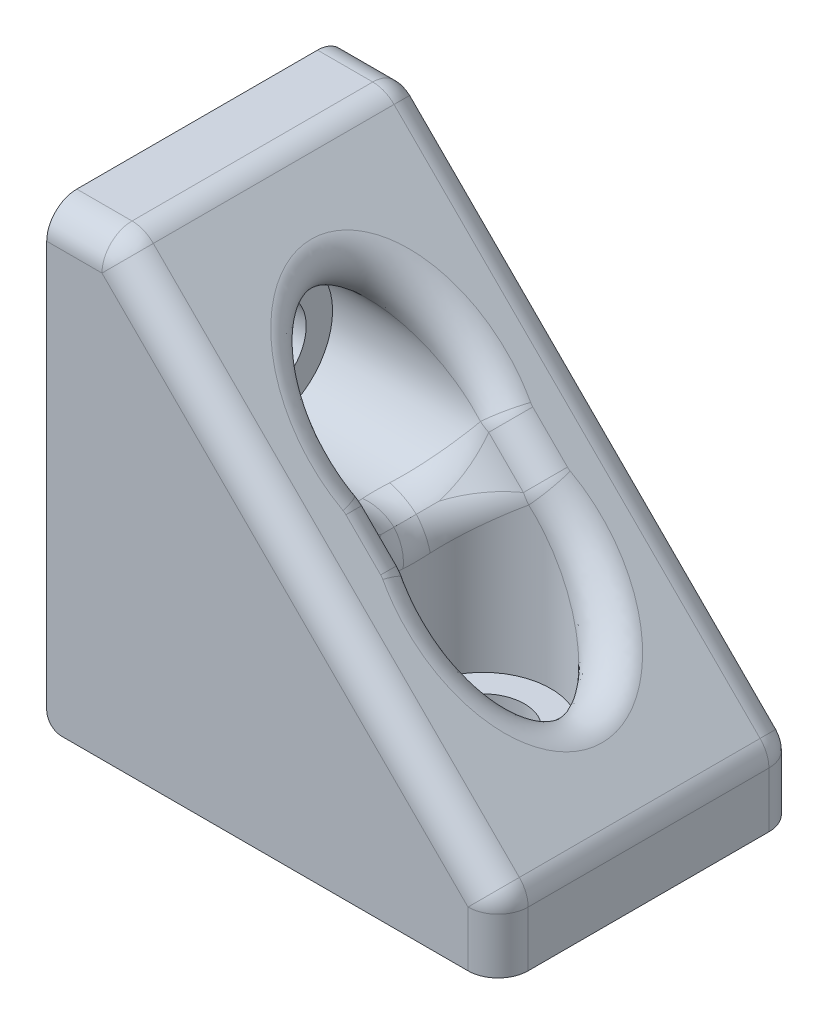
SolidWorks part; units mm, degrees
ref_plane "正面" through (0, 0, 0) normal (0, 0, 1) x (1, 0, 0)
ref_plane "平面" through (0, 0, 0) normal (0, 1, 0) x (1, 0, 0)
ref_plane "右側面" through (0, 0, 0) normal (1, 0, 0) x (0, 0, -1)
sketch "ｽｹｯﾁ1" plane through (0, 0, 0) normal (0, 0, 1) x (1, 0, 0)
  line L1 (0, 0) -> (30, 0)
  line L2 (0, 0) -> (0, 4.5)
  line L3 (0, 4.5) -> (30, 4.5)
  line L4 (30, 0) -> (30, 4.5)
  line L5 (0, 4.5) -> (4.5, 4.5)
  line L6 (0, 4.5) -> (0, 30)
  line L7 (0, 30) -> (4.5, 30)
  line L8 (4.5, 4.5) -> (4.5, 30)
  dimension "D1" = 4.5
  dimension "D2" = 4.5
  dimension "D3" = 30
  dimension "D4" = 30
extrude "ﾎﾞｽ - 押し出し1" add sketch "ｽｹｯﾁ1" along normal blind 20 contours L6 L5 L8 L7 | L2 L1 L4 L3
sketch "ｽｹｯﾁ3" plane through (0, 4.5, 0) normal (0, 1, 0) x (1, 0, 0)
  line L0 (4.5, 0) -> (30, 0) construction
  line L1 (30, -20) -> (30, 0) construction
  circle A0 centre (19, -10) radius 2.75
  dimension "D1" = 5.5
  dimension "D2" = 10
  dimension "D3" = 11
extrude "ｶｯﾄ - 押し出し2" cut sketch "ｽｹｯﾁ3" against normal blind 20 contours A0
sketch "ｽｹｯﾁ4" plane through (0, 0, 20) normal (0, 0, 1) x (1, 0, 0)
  line L0 (4.5, 30) -> (30, 4.5)
  line L1 (30, 4.5) -> (4.5, 4.5)
  line L2 (4.5, 4.5) -> (4.5, 30)
extrude "ﾎﾞｽ - 押し出し2" add sketch "ｽｹｯﾁ4" against normal blind 4 contours L2 L0 L1
sketch "ｽｹｯﾁ5" plane through (0, 0, 0) normal (0, 0, -1) x (-1, 0, 0)
  line L0 (-4.5, 30) -> (-4.5, 4.5)
  line L1 (-4.5, 4.5) -> (-30, 4.5)
  line L2 (-30, 4.5) -> (-4.5, 30)
extrude "ﾎﾞｽ - 押し出し3" add sketch "ｽｹｯﾁ5" against normal blind 16 contours L2 L0 L1
sketch "ｽｹｯﾁ7" plane through (0, 30, 0) normal (0, 1, 0) x (1, 0, 0)
  circle A0 centre (19, -10) radius 4.5
  dimension "D1" = 9
extrude "ｶｯﾄ - 押し出し3" cut sketch "ｽｹｯﾁ7" against normal blind 25.5 contours A0
sketch "ｽｹｯﾁ12" plane through (0, 0, 0) normal (-1, 0, 0) x (0, 0, 1)
  line L0 (0, 0) -> (0, 30) construction
  line L1 (20, 30) -> (0, 30) construction
  circle A0 centre (10, 19) radius 2.75
  dimension "D1" = 10
  dimension "D2" = 5.5
  dimension "D3" = 11
extrude "ｶｯﾄ - 押し出し8" cut sketch "ｽｹｯﾁ12" against normal blind 4.5 contours A0
sketch "ｽｹｯﾁ13" plane through (30, 0, 0) normal (1, 0, 0) x (0, 0, -1)
  circle A0 centre (-10, 19) radius 4.5
  dimension "D1" = 9
extrude "ｶｯﾄ - 押し出し9" cut sketch "ｽｹｯﾁ13" against normal blind 25.5 contours A0
sketch "ｽｹｯﾁ14" plane through (17.25, 17.25, 0) normal (0.7071, 0.7071, 0) x (0.7071, -0.7071, 0)
  line L6 (-2.4749, -5.5) -> (-2.4749, -14.5)
  line L7 (-2.4749, -5.5) -> (2.5342, -5.5)
  line L8 (-2.4749, -14.5) -> (2.5342, -14.5)
  line L9 (2.5342, -5.5) -> (2.5342, -14.5)
extrude "ｶｯﾄ - 押し出し10" cut sketch "ｽｹｯﾁ14" against normal blind 5
sketch "ｽｹｯﾁ16" plane through (0, 0, 0) normal (-1, 0, 0) x (0, 0, 1)
  line L0 (20, 0) -> (0, 0) construction
  line L1 (7, 0) -> (13, 0)
  line L2 (7, 0) -> (7, 12)
  line L3 (7, 12) -> (13, 12)
  line L4 (13, 0) -> (13, 12)
  line L5 (0, 0) -> (0, 30) construction
  dimension "D1" = 6
  dimension "D2" = 7
  dimension "D3" = 12
extrude "ﾎﾞｽ - 押し出し4" add sketch "ｽｹｯﾁ16" along normal blind 2 contours L2 L1 L4 L3
sketch "ｽｹｯﾁ17" plane through (0, 0, 0) normal (0, -1, 0) x (-1, 0, 0)
  line L0 (2, -13) -> (2, -7)
  line L1 (2, -13) -> (-12, -13)
  line L2 (2, -7) -> (-12, -7)
  line L3 (-12, -13) -> (-12, -7)
  line L4 (0, -20) -> (0, -13) construction
  dimension "D1" = 12
extrude "ﾎﾞｽ - 押し出し5" add sketch "ｽｹｯﾁ17" along normal blind 2 contours L0 L1 L3 L2
fillet "ﾌｨﾚｯﾄ5" radius 1 7 edges at (5, -2, 13) (12, -2, 10) (5, -2, 7) (-2, 5, 13) (-2, -2, 10) (-2, 5, 7) (-2, 12, 10)
fillet "ﾌｨﾚｯﾄ28" radius 5 2 edges at (13.7354, 13.6935, 14.5) (13.7354, 13.6935, 5.5)
fillet "ﾌｨﾚｯﾄ29" radius 2 4 edges at (11, 23.5, 10)
fillet "ﾌｨﾚｯﾄ30" radius 3 1 edges
fillet "ﾌｨﾚｯﾄ31" radius 3 10 edges at (18.3245, 15.6678, 4.9351) (18.3245, 15.6678, 15.0649) (14.507, 13.0266, 10.2511) (15.6678, 18.3245, 15.0649) (13.519, 15.1479, 12.3263) (13.0266, 14.507, 9.7489) (15.6678, 18.3245, 4.9351) (13.519, 15.1479, 7.6737)
fillet "ﾌｨﾚｯﾄ32" radius 1 2 edges at (0, 0, 3.5) (0, 0, 16.5)
fillet "ﾌｨﾚｯﾄ33" radius 2 8 edges at (4.5, 30, 10) (17.25, 17.25, 20) (17.25, 17.25, 0) (30, 4.5, 10) (30, 2.25, 0) (30, 2.25, 20) (2.25, 30, 0) (2.25, 30, 20)
